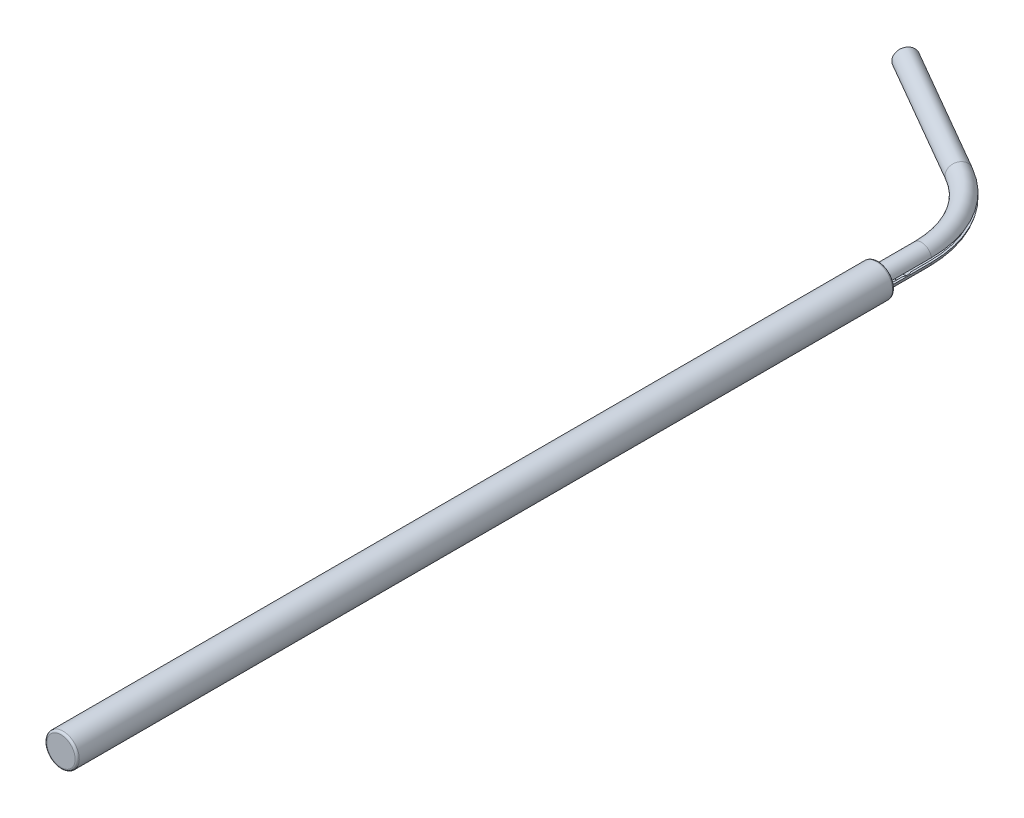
SolidWorks part; units mm, degrees
ref_plane "Front Plane" through (0, 0, 0) normal (0, 0, 1) x (1, 0, 0)
ref_plane "Top Plane" through (0, 0, 0) normal (0, 1, 0) x (1, 0, 0)
ref_plane "Right Plane" through (0, 0, 0) normal (1, 0, 0) x (0, 0, -1)
sketch "Sketch1" plane through (0, 0, 0) normal (0, 0, 1) x (1, 0, 0)
  circle A0 centre (0, 0) radius 3.9688
  dimension "D1" = 7.9375
extrude "Extrude1" add sketch "Sketch1" against normal blind 200
fillet "Fillet1" radius 0.508 2 edges at (3.9688, 0, 0) (3.9688, 0, -200)
sketch "Sketch2" plane through (0, 0, 0) normal (0, 1, 0) x (1, 0, 0)
  line L0 (0, 200) -> (0, 210.5662)
  line L1 (3.4608, 200) -> (-3.4608, 200) construction
  line L2 (-12.5, 232.2169) -> (-43.3013, 250)
  arc A0 (-12.5, 232.2169) -> (0, 210.5662) centre (-25, 210.5662) cw
  point P7 (0, 225)
  point P8 (0, 225)
  dimension "D4" = 60
  dimension "D1" = 25
  dimension "D2" = 25
  dimension "D3" = 50
sketch "Sketch3" plane through (0, 0, -200) normal (0, 0, -1) x (-1, 0, 0)
  line L1 (-2.4495, 0.5) -> (-1.9365, 0.5)
  line L2 (-2.4495, 0.5) -> (-1.9365, 0.5) construction
  line L3 (-2.4495, 0.5) -> (-2.4495, -0.5) construction
  line L4 (-2.4495, -0.5) -> (-1.9365, -0.5) construction
  line L6 (-1.9365, -0.5) -> (-2.4495, -0.5)
  arc A0 (-1.9365, -0.5) -> (-1.9365, 0.5) centre (0, 0) ccw
  arc A1 (-2.4495, -0.5) -> (-2.4495, 0.5) centre (0, 0) ccw
  point P6 (-2.4495, 0)
  dimension "D1" = 5
  dimension "D3" = 4
  dimension "D2" = 1
sweep "Sweep1" add profiles "Sketch3" path "Sketch2"
ref_plane "Plane1" through (0, 0, -205) normal (0, 0, -1) x (-1, 0, 0)
sketch "Sketch4" plane through (0, 0, -205) normal (0, 0, -1) x (-1, 0, 0)
  line L0 (0, 0) -> (0, 3.9688) construction
  line L1 (0, 2.25) -> (0, -2.25)
  circle A0 centre (0, 0) radius 3.9688 construction
  arc A1 (0, -2.25) -> (0, 2.25) centre (0, 0) ccw
  dimension "D1" = 2.25
revolve "Cut-Revolve3" cut sketch "Sketch4" angle 360 about L0
equation "\"D1@Sketch3\" = \"D3@Sketch3\"+1"
equation "\"D1@Sketch4\" = (  \"D3@Sketch3\"+\"D1@Sketch3\")/4"
